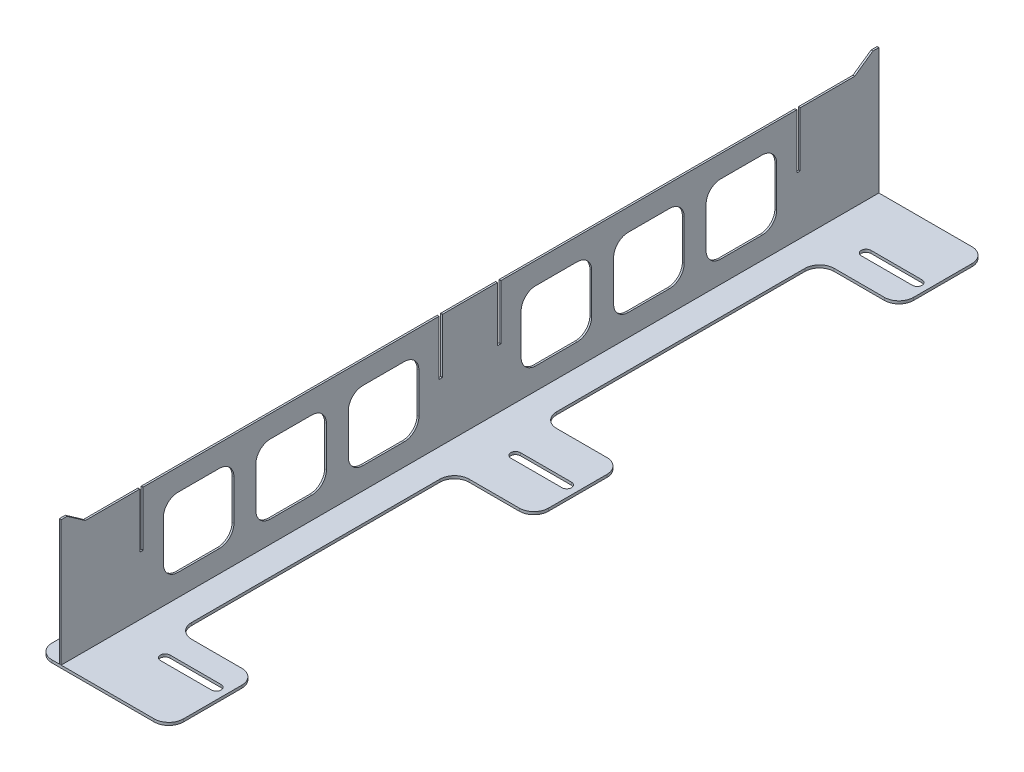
SolidWorks part; units mm, degrees
ref_plane "Front Plane" through (0, 0, 0) normal (0, 0, 1) x (1, 0, 0)
ref_plane "Top Plane" through (0, 0, 0) normal (0, 1, 0) x (1, 0, 0)
ref_plane "Right Plane" through (0, 0, 0) normal (1, 0, 0) x (0, 0, -1)
sketch "Sketch2" plane through (0, 0, 0) normal (0, 1, 0) x (1, 0, 0)
  line L0 (0, 1422.4) -> (0, -1422.4) construction
  line L1 (-28.575, 1422.4) -> (327.025, 1422.4)
  line L2 (-79.375, 1371.6) -> (-79.375, -1371.6)
  line L3 (-28.575, -1422.4) -> (327.025, -1422.4)
  line L4 (377.825, 1371.6) -> (377.825, 1168.4)
  line L5 (327.025, -1117.6) -> (152.4, -1117.6)
  line L6 (101.6, -1066.8) -> (101.6, -203.2)
  line L7 (152.4, -152.4) -> (327.025, -152.4)
  line L8 (3.429, -1214.374) -> (257.429, -1214.374) construction
  line L9 (3.429, -1223.899) -> (257.429, -1223.899) construction
  line L10 (3.429, -1214.374) -> (257.429, -1214.374) construction
  line L11 (3.429, -1223.899) -> (257.429, -1223.899) construction
  line L12 (327.025, 152.4) -> (152.4, 152.4)
  line L13 (101.6, 203.2) -> (101.6, 1066.8)
  line L14 (152.4, 1117.6) -> (327.025, 1117.6)
  line L15 (101.6, -152.4) -> (101.6, 152.4) construction
  line L16 (101.6, 0) -> (0, 0) construction
  line L17 (377.825, 101.6) -> (377.825, -101.6)
  line L18 (377.825, -1168.4) -> (377.825, -1371.6)
  line L19 (161.925, 16.6687) -> (339.725, 16.6687)
  line L20 (161.925, -16.6687) -> (339.725, -16.6687)
  line L21 (161.925, 1202.5312) -> (339.725, 1202.5312)
  line L22 (161.925, 1235.8688) -> (339.725, 1235.8688)
  line L23 (161.925, -1202.5312) -> (339.725, -1202.5312)
  line L24 (161.925, -1235.8688) -> (339.725, -1235.8688)
  arc A0 (-79.375, 1371.6) -> (-28.575, 1422.4) centre (-28.575, 1371.6) cw
  arc A1 (-28.575, -1422.4) -> (-79.375, -1371.6) centre (-28.575, -1371.6) cw
  arc A2 (377.825, -1371.6) -> (327.025, -1422.4) centre (327.025, -1371.6) cw
  arc A3 (377.825, -1168.4) -> (327.025, -1117.6) centre (327.025, -1168.4) ccw
  arc A4 (152.4, -1117.6) -> (101.6, -1066.8) centre (152.4, -1066.8) cw
  arc A5 (101.6, -203.2) -> (152.4, -152.4) centre (152.4, -203.2) cw
  arc A6 (327.025, -152.4) -> (377.825, -101.6) centre (327.025, -101.6) ccw
  arc A7 (377.825, 101.6) -> (327.025, 152.4) centre (327.025, 101.6) ccw
  arc A8 (152.4, 152.4) -> (101.6, 203.2) centre (152.4, 203.2) cw
  arc A9 (101.6, 1066.8) -> (152.4, 1117.6) centre (152.4, 1066.8) cw
  arc A10 (327.025, 1117.6) -> (377.825, 1168.4) centre (327.025, 1168.4) ccw
  arc A11 (377.825, 1371.6) -> (327.025, 1422.4) centre (327.025, 1371.6) ccw
  arc A12 (339.725, -16.6687) -> (339.725, 16.6687) centre (339.725, 0) ccw
  arc A13 (161.925, 16.6687) -> (161.925, -16.6687) centre (161.925, 0) ccw
  arc A14 (161.925, 1235.8688) -> (161.925, 1202.5312) centre (161.925, 1219.2) ccw
  arc A15 (339.725, 1202.5312) -> (339.725, 1235.8688) centre (339.725, 1219.2) ccw
  arc A16 (161.925, -1202.5312) -> (161.925, -1235.8688) centre (161.925, -1219.2) ccw
  arc A17 (339.725, -1235.8688) -> (339.725, -1202.5312) centre (339.725, -1219.2) ccw
  point P25 (-79.375, -1422.4)
  point P28 (377.825, -1422.4)
  point P31 (377.825, -1117.6)
  point P39 (377.825, -152.4)
  point P42 (377.825, 152.4)
  point P52 (377.825, 1422.4)
  dimension "D8" = 50.8
  dimension "D9" = 33.3375
  dimension "D10" = 177.8
  dimension "D11" = 38.1
  dimension "D14" = 161.925
  dimension "D1" = 457.2
  dimension "D2" = 79.375
  dimension "D3" = 2844.8
  dimension "D4" = 304.8
  dimension "D5" = 101.6
  dimension "D6" = 304.8
  dimension "D7" = 304.8
  dimension "D12" = 2
  dimension "D13" = 1219.2
  dimension "D15" = 2
extrude "Boss-Extrude1" add sketch "Sketch2" along normal blind 9.525
sketch "Sketch4" plane through (0, 0, 0) normal (1, 0, 0) x (0, 0, -1)
  line L0 (177.8, 276.225) -> (177.8, 136.525)
  line L1 (-1422.4, 9.525) -> (1422.4, 9.525)
  line L2 (-1422.4, 9.525) -> (-1422.4, 403.225)
  line L3 (-1338.2625, 403.225) -> (-1149.35, 403.225)
  line L4 (1422.4, 9.525) -> (1422.4, 403.225)
  line L5 (-101.6, 416.959) -> (-101.6, 200.5073) construction
  line L6 (-107.188, 402.463) -> (-107.188, 213.487)
  line L7 (-96.012, 402.463) -> (-96.012, 213.487)
  line L8 (-106.426, 212.725) -> (-96.774, 212.725)
  line L9 (1137.412, 402.463) -> (1137.412, 213.487)
  line L10 (1148.588, 402.463) -> (1148.588, 213.487)
  line L11 (1138.174, 212.725) -> (1147.826, 212.725)
  line L12 (1143, 403.225) -> (1143, 212.725) construction
  line L13 (-1148.588, 402.463) -> (-1148.588, 213.487)
  line L14 (-1137.412, 402.463) -> (-1137.412, 213.487)
  line L15 (-1147.826, 212.725) -> (-1138.174, 212.725)
  line L16 (-1143, 403.225) -> (-1143, 212.725) construction
  line L17 (-1136.65, 403.225) -> (-107.95, 403.225)
  line L18 (1149.35, 403.225) -> (1338.2625, 403.225)
  line L19 (-95.25, 403.225) -> (95.25, 403.225)
  line L20 (-96.012, 403.225) -> (-96.012, 200.5073) construction
  line L21 (-107.188, 403.225) -> (-107.188, 200.5073) construction
  line L22 (1338.2625, 403.225) -> (1401.7437, 447.675)
  line L23 (1422.4, 447.675) -> (1422.4, 403.225)
  line L24 (1401.7437, 447.675) -> (1422.4, 447.675)
  line L25 (1349.3334, 403.225) -> (1405.3859, 442.4734) construction
  line L26 (1425.582, 456.6149) -> (1405.3859, 442.4734) construction
  line L27 (1421.9398, 461.8165) -> (1401.7437, 447.675) construction
  line L28 (-1422.4, 9.525) -> (-1422.4, 0) construction
  line L29 (-1349.3334, 403.225) -> (-1405.3859, 442.4734) construction
  line L30 (-1401.7437, 447.675) -> (-1422.4, 447.675)
  line L31 (-1422.4, 447.675) -> (-1422.4, 403.225)
  line L32 (-1338.2625, 403.225) -> (-1401.7437, 447.675)
  line L33 (-1371.6, 9.525) -> (-1422.4, 9.525) construction
  line L34 (-101.6, 403.225) -> (-101.6, 200.5073) construction
  line L35 (0, 0) -> (0, -118.0816) construction
  line L36 (101.6, 416.959) -> (101.6, 200.5073) construction
  line L37 (106.426, 212.725) -> (96.774, 212.725)
  line L38 (96.012, 402.463) -> (96.012, 213.487)
  line L39 (107.188, 402.463) -> (107.188, 213.487)
  line L40 (107.95, 403.225) -> (1136.65, 403.225)
  line L41 (1168.4, 9.525) -> (1371.6, 9.525) construction
  line L42 (1422.4, 9.525) -> (1371.6, 9.525) construction
  line L43 (-1016, 327.025) -> (-872.0667, 327.025)
  line L44 (-1066.8, 276.225) -> (-1066.8, 136.525)
  line L45 (-1016, 85.725) -> (-872.0667, 85.725)
  line L46 (-821.2667, 276.225) -> (-821.2667, 136.525)
  line L47 (-694.2667, 327.025) -> (-550.3333, 327.025)
  line L48 (-745.0667, 276.225) -> (-745.0667, 136.525)
  line L49 (-694.2667, 85.725) -> (-550.3333, 85.725)
  line L50 (-499.5333, 276.225) -> (-499.5333, 136.525)
  line L51 (-372.5333, 327.025) -> (-228.6, 327.025)
  line L52 (-423.3333, 276.225) -> (-423.3333, 136.525)
  line L53 (-372.5333, 85.725) -> (-228.6, 85.725)
  line L54 (-177.8, 276.225) -> (-177.8, 136.525)
  line L55 (372.5333, 85.725) -> (228.6, 85.725)
  line L56 (423.3333, 276.225) -> (423.3333, 136.525)
  line L57 (372.5333, 327.025) -> (228.6, 327.025)
  line L58 (499.5333, 276.225) -> (499.5333, 136.525)
  line L59 (694.2667, 85.725) -> (550.3333, 85.725)
  line L60 (745.0667, 276.225) -> (745.0667, 136.525)
  line L61 (694.2667, 327.025) -> (550.3333, 327.025)
  line L62 (821.2667, 276.225) -> (821.2667, 136.525)
  line L63 (1016, 85.725) -> (872.0667, 85.725)
  line L64 (1066.8, 276.225) -> (1066.8, 136.525)
  line L65 (1016, 327.025) -> (872.0667, 327.025)
  arc A0 (-1136.65, 403.225) -> (-1137.412, 402.463) centre (-1136.65, 402.463) ccw
  arc A1 (-1149.35, 403.225) -> (-1148.588, 402.463) centre (-1149.35, 402.463) cw
  arc A2 (-1148.588, 213.487) -> (-1147.826, 212.725) centre (-1147.826, 213.487) ccw
  arc A3 (-1137.412, 213.487) -> (-1138.174, 212.725) centre (-1138.174, 213.487) cw
  arc A4 (1148.588, 213.487) -> (1147.826, 212.725) centre (1147.826, 213.487) cw
  arc A5 (1138.174, 212.725) -> (1137.412, 213.487) centre (1138.174, 213.487) cw
  arc A6 (1149.35, 403.225) -> (1148.588, 402.463) centre (1149.35, 402.463) ccw
  arc A7 (1137.412, 402.463) -> (1136.65, 403.225) centre (1136.65, 402.463) ccw
  arc A8 (-96.012, 402.463) -> (-95.25, 403.225) centre (-95.25, 402.463) cw
  arc A9 (-107.95, 403.225) -> (-107.188, 402.463) centre (-107.95, 402.463) cw
  arc A10 (-96.012, 213.487) -> (-96.774, 212.725) centre (-96.774, 213.487) cw
  arc A11 (-106.426, 212.725) -> (-107.188, 213.487) centre (-106.426, 213.487) cw
  arc A12 (106.426, 212.725) -> (107.188, 213.487) centre (106.426, 213.487) ccw
  arc A13 (96.012, 213.487) -> (96.774, 212.725) centre (96.774, 213.487) ccw
  arc A14 (107.95, 403.225) -> (107.188, 402.463) centre (107.95, 402.463) ccw
  arc A15 (96.012, 402.463) -> (95.25, 403.225) centre (95.25, 402.463) ccw
  arc A16 (-423.3333, 136.525) -> (-372.5333, 85.725) centre (-372.5333, 136.525) ccw
  arc A17 (-228.6, 85.725) -> (-177.8, 136.525) centre (-228.6, 136.525) ccw
  arc A18 (-177.8, 276.225) -> (-228.6, 327.025) centre (-228.6, 276.225) ccw
  arc A19 (-372.5333, 327.025) -> (-423.3333, 276.225) centre (-372.5333, 276.225) ccw
  arc A20 (-745.0667, 276.225) -> (-694.2667, 327.025) centre (-694.2667, 276.225) cw
  arc A21 (-550.3333, 327.025) -> (-499.5333, 276.225) centre (-550.3333, 276.225) cw
  arc A22 (-499.5333, 136.525) -> (-550.3333, 85.725) centre (-550.3333, 136.525) cw
  arc A23 (-694.2667, 85.725) -> (-745.0667, 136.525) centre (-694.2667, 136.525) cw
  arc A24 (-1066.8, 136.525) -> (-1016, 85.725) centre (-1016, 136.525) ccw
  arc A25 (-872.0667, 85.725) -> (-821.2667, 136.525) centre (-872.0667, 136.525) ccw
  arc A26 (-821.2667, 276.225) -> (-872.0667, 327.025) centre (-872.0667, 276.225) ccw
  arc A27 (-1016, 327.025) -> (-1066.8, 276.225) centre (-1016, 276.225) ccw
  arc A28 (1016, 327.025) -> (1066.8, 276.225) centre (1016, 276.225) cw
  arc A29 (821.2667, 276.225) -> (872.0667, 327.025) centre (872.0667, 276.225) cw
  arc A30 (872.0667, 85.725) -> (821.2667, 136.525) centre (872.0667, 136.525) cw
  arc A31 (1066.8, 136.525) -> (1016, 85.725) centre (1016, 136.525) cw
  arc A32 (694.2667, 85.725) -> (745.0667, 136.525) centre (694.2667, 136.525) ccw
  arc A33 (499.5333, 136.525) -> (550.3333, 85.725) centre (550.3333, 136.525) ccw
  arc A34 (550.3333, 327.025) -> (499.5333, 276.225) centre (550.3333, 276.225) ccw
  arc A35 (745.0667, 276.225) -> (694.2667, 327.025) centre (694.2667, 276.225) ccw
  arc A36 (372.5333, 327.025) -> (423.3333, 276.225) centre (372.5333, 276.225) cw
  arc A37 (177.8, 276.225) -> (228.6, 327.025) centre (228.6, 276.225) cw
  arc A38 (228.6, 85.725) -> (177.8, 136.525) centre (228.6, 136.525) cw
  arc A39 (423.3333, 136.525) -> (372.5333, 85.725) centre (372.5333, 136.525) cw
  point P28 (-1213.612, 403.225)
  dimension "D5" = 0.762
  dimension "D22" = 50.8
  dimension "D1" = 393.7
  dimension "D2" = 5.588
  dimension "D4" = 6.35
  dimension "D6" = 44.45
  dimension "D7" = 35
  dimension "D8" = 2676.525
  dimension "D9" = 393.7
  dimension "D10" = 101.6
  dimension "D11" = 11.176
  dimension "D12" = 1143
  dimension "D13" = 190.5
  dimension "D14" = 1143
  dimension "D15" = 11.176
  dimension "D16" = 76.2
  dimension "D17" = 76.2
  dimension "D18" = 76.2
  dimension "D19" = 76.2
  dimension "D20" = 76.2
  dimension "D21" = 76.2
  dimension "D3" = 5.588
extrude "Boss-Extrude3" add sketch "Sketch4" along normal mid plane 6.35 separate body
